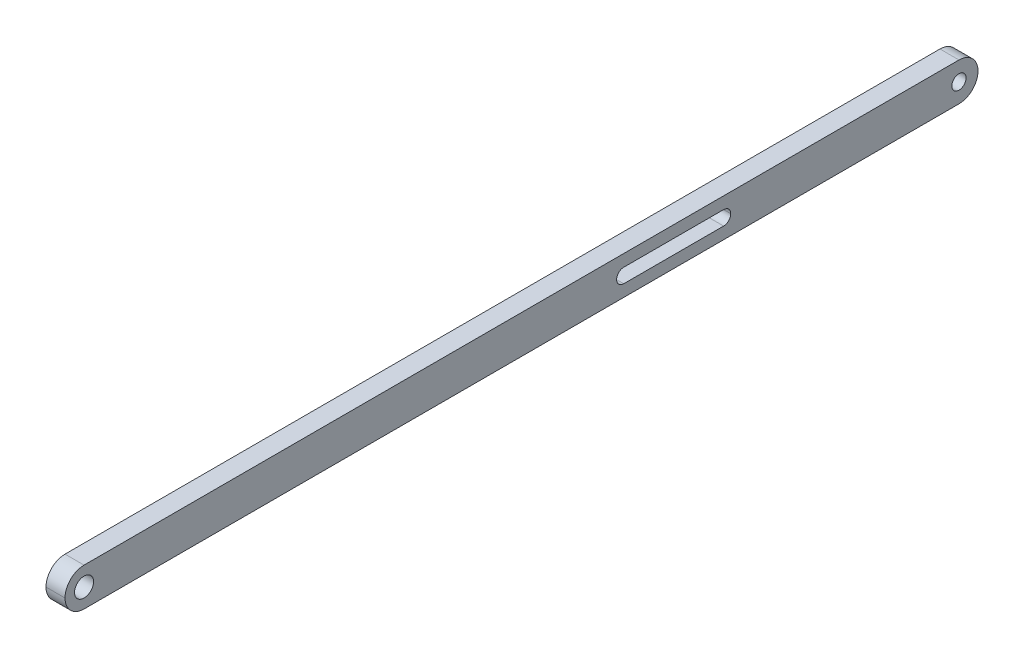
SolidWorks part; units mm, degrees
ref_plane "Front Plane" through (0, 0, 0) normal (0, 0, 1) x (1, 0, 0)
ref_plane "Top Plane" through (0, 0, 0) normal (0, 1, 0) x (1, 0, 0)
ref_plane "Right Plane" through (0, 0, 0) normal (1, 0, 0) x (0, 0, -1)
sketch "Sketch1" plane through (0, 0, 0) normal (0, 0, 1) x (1, 0, 0)
  line L1 (0, 0) -> (12.7, 0)
  line L2 (0, 0) -> (0, 25.4)
  line L3 (0, 25.4) -> (12.7, 25.4)
  line L4 (12.7, 0) -> (12.7, 25.4)
  dimension "D1" = 12.7
  dimension "D2" = 25.4
extrude "Extrude1" add sketch "Sketch1" against normal blind 609.6
sketch "Sketch2" plane through (12.7, 0, 0) normal (1, 0, 0) x (0, 0, -1)
  line L0 (609.6, 25.4) -> (0, 25.4) construction
  line L1 (609.6, 0) -> (609.6, 25.4) construction
  circle A0 centre (596.9, 12.7) radius 4.7625
  dimension "D1" = 9.525
  dimension "D2" = 12.7
  dimension "D3" = 12.7
extrude "Cut-Extrude1" cut sketch "Sketch2" against normal through all
sketch "Sketch3" plane through (12.7, 0, 0) normal (1, 0, 0) x (0, 0, -1)
  line L0 (0, 0) -> (0, 25.4) construction
  line L1 (609.6, 0) -> (0, 0) construction
  circle A0 centre (12.7, 12.7) radius 6.35
  dimension "D3" = 12.7
  dimension "D1" = 12.7
  dimension "D2" = 12.7
extrude "Cut-Extrude2" cut sketch "Sketch3" against normal blind 508
sketch "Sketch4" plane through (12.7, 0, 0) normal (1, 0, 0) x (0, 0, -1)
  line L0 (609.6, 0) -> (0, 0) construction
  line L1 (368.3, 7.9248) -> (444.5, 7.9248)
  line L2 (368.3, 7.9248) -> (368.3, 17.4498)
  line L3 (368.3, 17.4498) -> (444.5, 17.4498)
  line L4 (444.5, 7.9248) -> (444.5, 17.4498)
  line L5 (609.6, 0) -> (609.6, 25.4) construction
  point P6 (609.6, 12.7)
  dimension "D1" = 9.525
  dimension "D2" = 7.9248
  dimension "D3" = 165.1
  dimension "D4" = 76.2
extrude "Cut-Extrude3" cut sketch "Sketch4" against normal through all
fillet "Fillet1" radius 4.7498 4 edges at (6.35, 7.9248, -444.5) (6.35, 17.4498, -444.5) (6.35, 17.4498, -368.3) (6.35, 7.9248, -368.3)
fillet "Fillet2" radius 12.7 4 edges at (6.35, 0, 0) (6.35, 25.4, 0) (6.35, 0, -609.6) (6.35, 25.4, -609.6)
